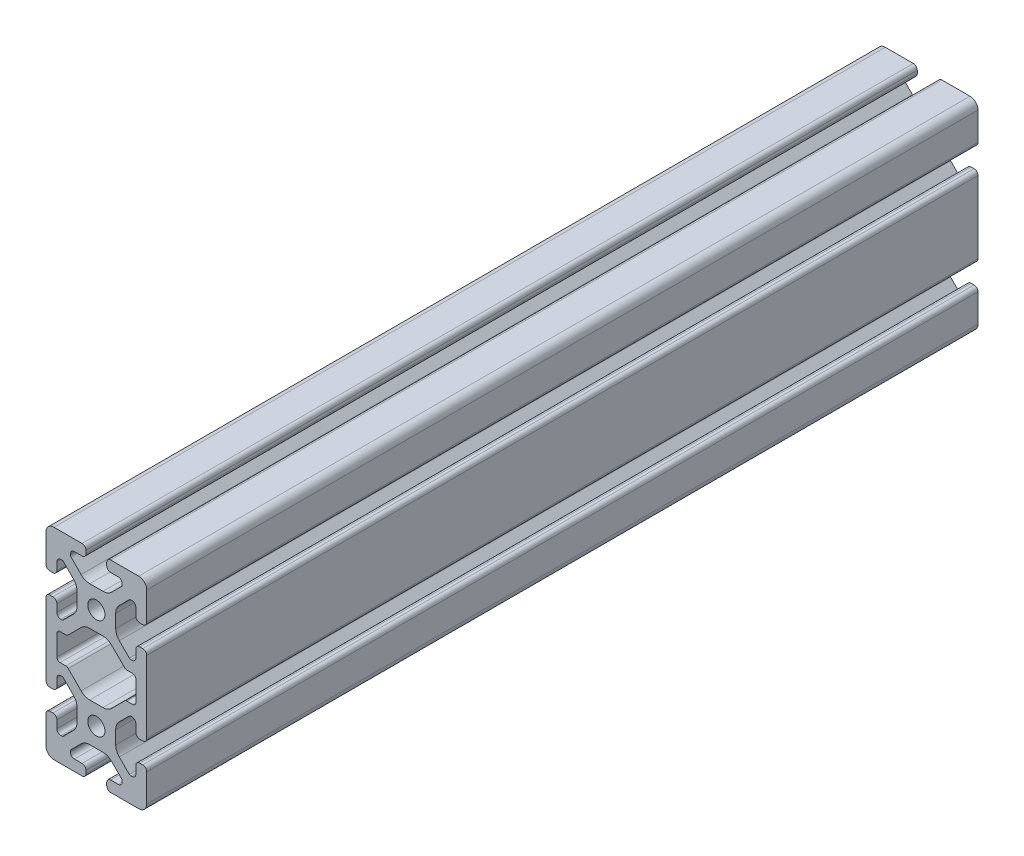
SolidWorks part; units mm, degrees
ref_plane "Front Plane" through (0, 0, 0) normal (0, 0, 1) x (1, 0, 0)
ref_plane "Top Plane" through (0, 0, 0) normal (0, 1, 0) x (1, 0, 0)
ref_plane "Right Plane" through (0, 0, 0) normal (1, 0, 0) x (0, 0, -1)
ref_plane "Plane1" through (0, 0, -3048) normal (0, 0, -1) x (-1, 0, 0)
sketch "Sketch1" plane through (0, 0, -3048) normal (0, 0, -1) x (-1, 0, 0)
  line L0 (14.41, 14.6586) -> (12.13, 14.6586)
  line L1 (11.1794, 14.2308) -> (6.0551, 9.1098)
  line L2 (2.6153, 7.685) -> (-2.6153, 7.685)
  line L3 (-6.0551, 9.1098) -> (-11.232, 14.2867)
  line L4 (-12.13, 14.6586) -> (-14.41, 14.6586)
  line L5 (-15.68, 15.9286) -> (-15.68, 24.0714)
  line L6 (-14.41, 25.3414) -> (-12.13, 25.3414)
  line L7 (-11.232, 25.7133) -> (-6.0551, 30.8902)
  line L8 (-2.6153, 32.315) -> (2.6176, 32.315)
  line L9 (6.0573, 30.8902) -> (11.1842, 25.7634)
  line L10 (12.13, 25.3414) -> (14.41, 25.3414)
  line L11 (15.68, 24.0714) -> (15.68, 15.9286)
  line L12 (16.83, 60) -> (5.6904, 60)
  line L13 (4.1204, 58.43) -> (4.1204, 57.25)
  line L14 (5.6904, 55.68) -> (8.7154, 55.68)
  line L15 (10.2854, 54.11) -> (10.2854, 53.6549)
  line L16 (10.0628, 53.1175) -> (6.0551, 49.1098)
  line L17 (2.6153, 47.685) -> (-2.6153, 47.685)
  line L18 (-6.0551, 49.1098) -> (-10.0628, 53.1175)
  line L19 (-10.2854, 53.6549) -> (-10.2854, 54.11)
  line L20 (-8.7154, 55.68) -> (-5.6904, 55.68)
  line L21 (-4.1204, 57.25) -> (-4.1204, 58.43)
  line L22 (-5.6904, 60) -> (-16.83, 60)
  line L23 (-20, 56.83) -> (-20, 45.6904)
  line L24 (-18.43, 44.1204) -> (-17.25, 44.1204)
  line L25 (-15.68, 45.6904) -> (-15.68, 48.7154)
  line L26 (-14.11, 50.2854) -> (-13.6527, 50.2854)
  line L27 (-13.1153, 50.0628) -> (-9.1098, 46.0573)
  line L28 (-7.685, 42.6176) -> (-7.685, 37.3847)
  line L29 (-9.1098, 33.9449) -> (-13.1175, 29.9372)
  line L30 (-13.6549, 29.7146) -> (-14.11, 29.7146)
  line L31 (-15.68, 31.2846) -> (-15.68, 34.3096)
  line L32 (-17.25, 35.8796) -> (-18.43, 35.8796)
  line L33 (-20, 34.3096) -> (-20, 5.6904)
  line L34 (-18.43, 4.1204) -> (-17.25, 4.1204)
  line L35 (-15.68, 5.6904) -> (-15.68, 8.7154)
  line L36 (-14.11, 10.2854) -> (-13.6549, 10.2854)
  line L37 (-13.1175, 10.0628) -> (-9.1098, 6.0551)
  line L38 (-7.685, 2.6153) -> (-7.685, -2.6153)
  line L39 (-9.1098, -6.0551) -> (-13.1175, -10.0628)
  line L40 (-13.6549, -10.2854) -> (-14.11, -10.2854)
  line L41 (-15.68, -8.7154) -> (-15.68, -5.6904)
  line L42 (-17.25, -4.1204) -> (-18.43, -4.1204)
  line L43 (-20, -5.6904) -> (-20, -16.83)
  line L44 (-16.83, -20) -> (-5.6904, -20)
  line L45 (-4.1204, -18.43) -> (-4.1204, -17.25)
  line L46 (-5.6904, -15.68) -> (-8.7154, -15.68)
  line L47 (-10.2854, -14.11) -> (-10.2854, -13.6549)
  line L48 (-10.0628, -13.1175) -> (-6.0551, -9.1098)
  line L49 (-2.6153, -7.685) -> (2.6153, -7.685)
  line L50 (6.0551, -9.1098) -> (10.0628, -13.1175)
  line L51 (10.2854, -13.6549) -> (10.2854, -14.11)
  line L52 (8.7154, -15.68) -> (5.6904, -15.68)
  line L53 (4.1204, -17.25) -> (4.1204, -18.43)
  line L54 (5.6904, -20) -> (16.83, -20)
  line L55 (20, -16.83) -> (20, -5.6904)
  line L56 (18.43, -4.1204) -> (17.25, -4.1204)
  line L57 (15.68, -5.6904) -> (15.68, -8.7154)
  line L58 (14.11, -10.2854) -> (13.6549, -10.2854)
  line L59 (13.1175, -10.0628) -> (9.1098, -6.0551)
  line L60 (7.685, -2.6153) -> (7.685, 2.6153)
  line L61 (9.1098, 6.0551) -> (13.1175, 10.0628)
  line L62 (13.6549, 10.2854) -> (14.11, 10.2854)
  line L63 (15.68, 8.7154) -> (15.68, 5.6904)
  line L64 (17.25, 4.1204) -> (18.43, 4.1204)
  line L65 (20, 5.6904) -> (20, 34.3096)
  line L66 (18.43, 35.8796) -> (17.25, 35.8796)
  line L67 (15.68, 34.3096) -> (15.68, 31.2846)
  line L68 (14.11, 29.7146) -> (13.6549, 29.7146)
  line L69 (13.1175, 29.9372) -> (9.1098, 33.9449)
  line L70 (7.685, 37.3847) -> (7.685, 42.6153)
  line L71 (9.1098, 46.0551) -> (13.1175, 50.0628)
  line L72 (13.6549, 50.2854) -> (14.11, 50.2854)
  line L73 (15.68, 48.7154) -> (15.68, 45.6904)
  line L74 (17.25, 44.1204) -> (18.43, 44.1204)
  line L75 (20, 45.6904) -> (20, 56.83)
  arc A0 (15.68, 15.9286) -> (14.41, 14.6586) centre (14.41, 15.9286) cw
  arc A1 (12.13, 14.6586) -> (11.1794, 14.2308) centre (12.13, 13.3886) ccw
  arc A2 (6.0551, 9.1098) -> (2.6153, 7.685) centre (2.6153, 12.5496) cw
  arc A3 (-2.6153, 7.685) -> (-6.0551, 9.1098) centre (-2.6153, 12.5496) cw
  arc A4 (-11.232, 14.2867) -> (-12.13, 14.6586) centre (-12.13, 13.3886) ccw
  arc A5 (-14.41, 14.6586) -> (-15.68, 15.9286) centre (-14.41, 15.9286) cw
  arc A6 (-15.68, 24.0714) -> (-14.41, 25.3414) centre (-14.41, 24.0714) cw
  arc A7 (-12.13, 25.3414) -> (-11.232, 25.7133) centre (-12.13, 26.6114) ccw
  arc A8 (-6.0551, 30.8902) -> (-2.6153, 32.315) centre (-2.6153, 27.4504) cw
  arc A9 (2.6176, 32.315) -> (6.0573, 30.8902) centre (2.6176, 27.4504) cw
  arc A10 (11.1842, 25.7634) -> (12.13, 25.3414) centre (12.13, 26.6123) ccw
  arc A11 (14.41, 25.3414) -> (15.68, 24.0714) centre (14.41, 24.0714) cw
  circle A12 centre (0, 0) radius 3.405
  circle A13 centre (0, 40) radius 3.405
  arc A14 (5.6904, 60) -> (4.1204, 58.43) centre (5.6904, 58.43) ccw
  arc A15 (4.1204, 57.25) -> (5.6904, 55.68) centre (5.6904, 57.25) ccw
  arc A16 (8.7154, 55.68) -> (10.2854, 54.11) centre (8.7154, 54.11) cw
  arc A17 (10.2854, 53.6549) -> (10.0628, 53.1175) centre (9.5254, 53.6549) cw
  arc A18 (6.0551, 49.1098) -> (2.6153, 47.685) centre (2.6153, 52.5496) cw
  arc A19 (-2.6153, 47.685) -> (-6.0551, 49.1098) centre (-2.6153, 52.5496) cw
  arc A20 (-10.0628, 53.1175) -> (-10.2854, 53.6549) centre (-9.5254, 53.6549) cw
  arc A21 (-10.2854, 54.11) -> (-8.7154, 55.68) centre (-8.7154, 54.11) cw
  arc A22 (-5.6904, 55.68) -> (-4.1204, 57.25) centre (-5.6904, 57.25) ccw
  arc A23 (-4.1204, 58.43) -> (-5.6904, 60) centre (-5.6904, 58.43) ccw
  arc A24 (-16.83, 60) -> (-20, 56.83) centre (-16.83, 56.83) ccw
  arc A25 (-20, 45.6904) -> (-18.43, 44.1204) centre (-18.43, 45.6904) ccw
  arc A26 (-17.25, 44.1204) -> (-15.68, 45.6904) centre (-17.25, 45.6904) ccw
  arc A27 (-15.68, 48.7154) -> (-14.11, 50.2854) centre (-14.11, 48.7154) cw
  arc A28 (-13.6527, 50.2854) -> (-13.1153, 50.0628) centre (-13.6527, 49.5254) cw
  arc A29 (-9.1098, 46.0573) -> (-7.685, 42.6176) centre (-12.5496, 42.6176) cw
  arc A30 (-7.685, 37.3847) -> (-9.1098, 33.9449) centre (-12.5496, 37.3847) cw
  arc A31 (-13.1175, 29.9372) -> (-13.6549, 29.7146) centre (-13.6549, 30.4746) cw
  arc A32 (-14.11, 29.7146) -> (-15.68, 31.2846) centre (-14.11, 31.2846) cw
  arc A33 (-15.68, 34.3096) -> (-17.25, 35.8796) centre (-17.25, 34.3096) ccw
  arc A34 (-18.43, 35.8796) -> (-20, 34.3096) centre (-18.43, 34.3096) ccw
  arc A35 (-20, 5.6904) -> (-18.43, 4.1204) centre (-18.43, 5.6904) ccw
  arc A36 (-17.25, 4.1204) -> (-15.68, 5.6904) centre (-17.25, 5.6904) ccw
  arc A37 (-15.68, 8.7154) -> (-14.11, 10.2854) centre (-14.11, 8.7154) cw
  arc A38 (-13.6549, 10.2854) -> (-13.1175, 10.0628) centre (-13.6549, 9.5254) cw
  arc A39 (-9.1098, 6.0551) -> (-7.685, 2.6153) centre (-12.5496, 2.6153) cw
  arc A40 (-7.685, -2.6153) -> (-9.1098, -6.0551) centre (-12.5496, -2.6153) cw
  arc A41 (-13.1175, -10.0628) -> (-13.6549, -10.2854) centre (-13.6549, -9.5254) cw
  arc A42 (-14.11, -10.2854) -> (-15.68, -8.7154) centre (-14.11, -8.7154) cw
  arc A43 (-15.68, -5.6904) -> (-17.25, -4.1204) centre (-17.25, -5.6904) ccw
  arc A44 (-18.43, -4.1204) -> (-20, -5.6904) centre (-18.43, -5.6904) ccw
  arc A45 (-20, -16.83) -> (-16.83, -20) centre (-16.83, -16.83) ccw
  arc A46 (-5.6904, -20) -> (-4.1204, -18.43) centre (-5.6904, -18.43) ccw
  arc A47 (-4.1204, -17.25) -> (-5.6904, -15.68) centre (-5.6904, -17.25) ccw
  arc A48 (-8.7154, -15.68) -> (-10.2854, -14.11) centre (-8.7154, -14.11) cw
  arc A49 (-10.2854, -13.6549) -> (-10.0628, -13.1175) centre (-9.5254, -13.6549) cw
  arc A50 (-6.0551, -9.1098) -> (-2.6153, -7.685) centre (-2.6153, -12.5496) cw
  arc A51 (2.6153, -7.685) -> (6.0551, -9.1098) centre (2.6153, -12.5496) cw
  arc A52 (10.0628, -13.1175) -> (10.2854, -13.6549) centre (9.5254, -13.6549) cw
  arc A53 (10.2854, -14.11) -> (8.7154, -15.68) centre (8.7154, -14.11) cw
  arc A54 (5.6904, -15.68) -> (4.1204, -17.25) centre (5.6904, -17.25) ccw
  arc A55 (4.1204, -18.43) -> (5.6904, -20) centre (5.6904, -18.43) ccw
  arc A56 (16.83, -20) -> (20, -16.83) centre (16.83, -16.83) ccw
  arc A57 (20, -5.6904) -> (18.43, -4.1204) centre (18.43, -5.6904) ccw
  arc A58 (17.25, -4.1204) -> (15.68, -5.6904) centre (17.25, -5.6904) ccw
  arc A59 (15.68, -8.7154) -> (14.11, -10.2854) centre (14.11, -8.7154) cw
  arc A60 (13.6549, -10.2854) -> (13.1175, -10.0628) centre (13.6549, -9.5254) cw
  arc A61 (9.1098, -6.0551) -> (7.685, -2.6153) centre (12.5496, -2.6153) cw
  arc A62 (7.685, 2.6153) -> (9.1098, 6.0551) centre (12.5496, 2.6153) cw
  arc A63 (13.1175, 10.0628) -> (13.6549, 10.2854) centre (13.6549, 9.5254) cw
  arc A64 (14.11, 10.2854) -> (15.68, 8.7154) centre (14.11, 8.7154) cw
  arc A65 (15.68, 5.6904) -> (17.25, 4.1204) centre (17.25, 5.6904) ccw
  arc A66 (18.43, 4.1204) -> (20, 5.6904) centre (18.43, 5.6904) ccw
  arc A67 (20, 34.3096) -> (18.43, 35.8796) centre (18.43, 34.3096) ccw
  arc A68 (17.25, 35.8796) -> (15.68, 34.3096) centre (17.25, 34.3096) ccw
  arc A69 (15.68, 31.2846) -> (14.11, 29.7146) centre (14.11, 31.2846) cw
  arc A70 (13.6549, 29.7146) -> (13.1175, 29.9372) centre (13.6549, 30.4746) cw
  arc A71 (9.1098, 33.9449) -> (7.685, 37.3847) centre (12.5496, 37.3847) cw
  arc A72 (7.685, 42.6153) -> (9.1098, 46.0551) centre (12.5496, 42.6153) cw
  arc A73 (13.1175, 50.0628) -> (13.6549, 50.2854) centre (13.6549, 49.5254) cw
  arc A74 (14.11, 50.2854) -> (15.68, 48.7154) centre (14.11, 48.7154) cw
  arc A75 (15.68, 45.6904) -> (17.25, 44.1204) centre (17.25, 45.6904) ccw
  arc A76 (18.43, 44.1204) -> (20, 45.6904) centre (18.43, 45.6904) ccw
  arc A77 (20, 56.83) -> (16.83, 60) centre (16.83, 56.83) ccw
extrude "Boss-Extrude1" add sketch "Sketch1" against normal blind 3048
ref_plane "Plane2" through (0, 0, -914.4) normal (0, 0, 1) x (1, 0, 0)
ref_plane "Plane3" through (0, 0, -1828.8) normal (0, 0, 1) x (1, 0, 0)
ref_plane "Plane4" through (0, 0, -2159) normal (0, 0, 1) x (1, 0, 0)
ref_plane "Plane5" through (0, 0, -2489.2) normal (0, 0, 1) x (1, 0, 0)
sketch "Sketch26" plane through (0, 0, -914.4) normal (0, 0, 1) x (1, 0, 0)
  line L0 (-20, -20.8001) -> (20, -20.8001)
  line L1 (-20, -20.8001) -> (-20, 60)
  line L2 (-20, 60) -> (20, 60)
  line L3 (20, -20.8001) -> (20, 60)
sketch "Sketch33" plane through (0, 0, -1828.8) normal (0, 0, 1) x (1, 0, 0)
  line L0 (-20, -20.8001) -> (20, -20.8001)
  line L1 (-20, -20.8001) -> (-20, 60)
  line L2 (-20, 60) -> (20, 60)
  line L3 (20, -20.8001) -> (20, 60)
sketch "Sketch41" plane through (0, 0, -2159) normal (0, 0, 1) x (1, 0, 0)
  line L0 (-20, -20.8001) -> (20, -20.8001)
  line L1 (-20, -20.8001) -> (-20, 60)
  line L2 (-20, 60) -> (20, 60)
  line L3 (20, -20.8001) -> (20, 60)
sketch "Sketch50" plane through (0, 0, -2489.2) normal (0, 0, 1) x (1, 0, 0)
  line L0 (-20, -20.8001) -> (20, -20.8001)
  line L1 (-20, -20.8001) -> (-20, 60)
  line L2 (-20, 60) -> (20, 60)
  line L3 (20, -20.8001) -> (20, 60)
extrude "Cut 1 - 3ft" cut sketch "Sketch26" along normal through all
extrude "Cut 2 - 3ft" cut sketch "Sketch33" along normal through all
extrude "Cut 3 - 1ft" cut sketch "Sketch41" along normal through all
extrude "Cut 4 - 1ft" cut sketch "Sketch50" against normal through all
